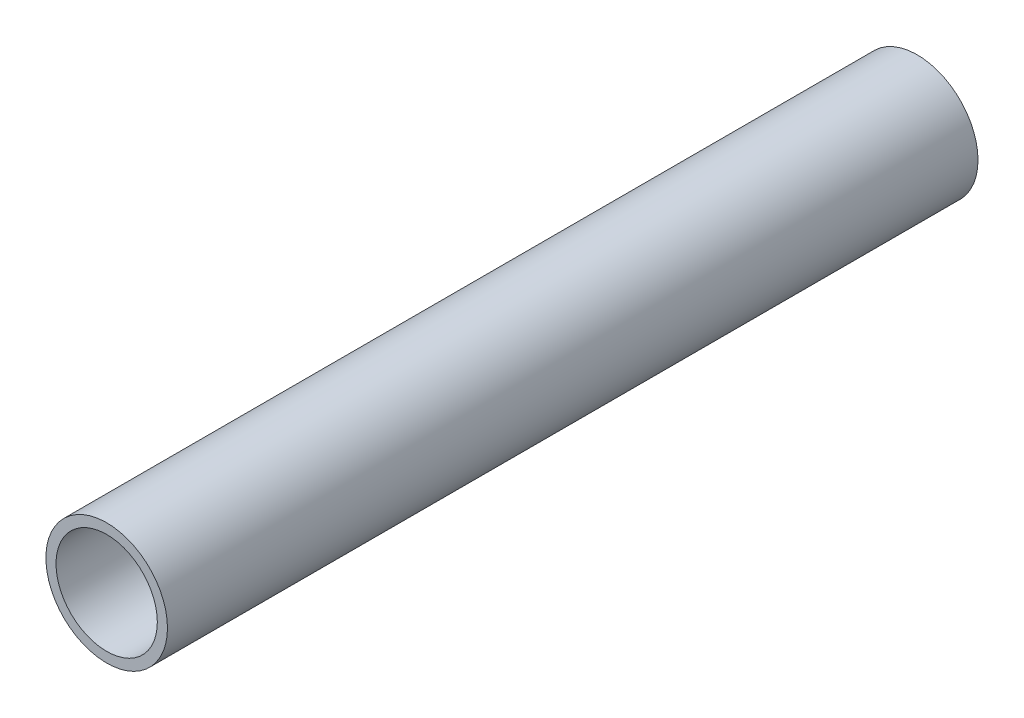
SolidWorks part; units mm, degrees
ref_plane "Plan de face" through (0, 0, 0) normal (0, 0, 1) x (1, 0, 0)
ref_plane "Plan de dessus" through (0, 0, 0) normal (0, 1, 0) x (1, 0, 0)
ref_plane "Plan de droite" through (0, 0, 0) normal (1, 0, 0) x (0, 0, -1)
sketch "Esquisse1" plane through (0, 0, 0) normal (0, 0, 1) x (1, 0, 0)
  circle A0 centre (0, 0) radius 6
  circle A1 centre (0, 0) radius 5
  dimension "D1" = 12
  dimension "D2" = 1
extrude "Extrusion1" add sketch "Esquisse1" along normal mid plane 80
